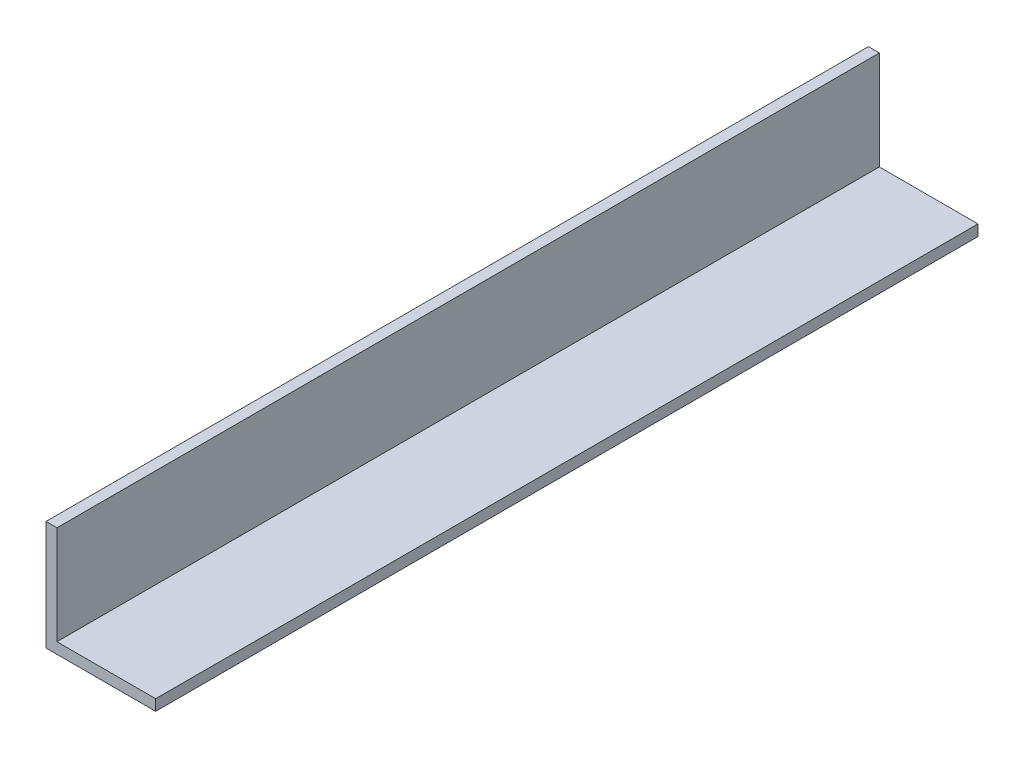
SolidWorks part; units mm, degrees
ref_plane "前视基准面" through (0, 0, 0) normal (0, 0, 1) x (1, 0, 0)
ref_plane "上视基准面" through (0, 0, 0) normal (0, 1, 0) x (1, 0, 0)
ref_plane "右视基准面" through (0, 0, 0) normal (1, 0, 0) x (0, 0, -1)
sketch "草图1" plane through (0, 0, 0) normal (0, 0, 1) x (1, 0, 0)
  line L0 (0, 0) -> (0, 36)
  line L1 (0, 36) -> (-4, 36)
  line L2 (-4, 36) -> (-4, -4)
  line L3 (-4, -4) -> (36, -4)
  line L4 (36, -4) -> (36, 0)
  line L5 (36, 0) -> (0, 0)
  dimension "D1" = 40
  dimension "D2" = 36
  dimension "D3" = 40
  dimension "D4" = 4
extrude "凸台-拉伸1" add sketch "草图1" along normal mid plane 300
